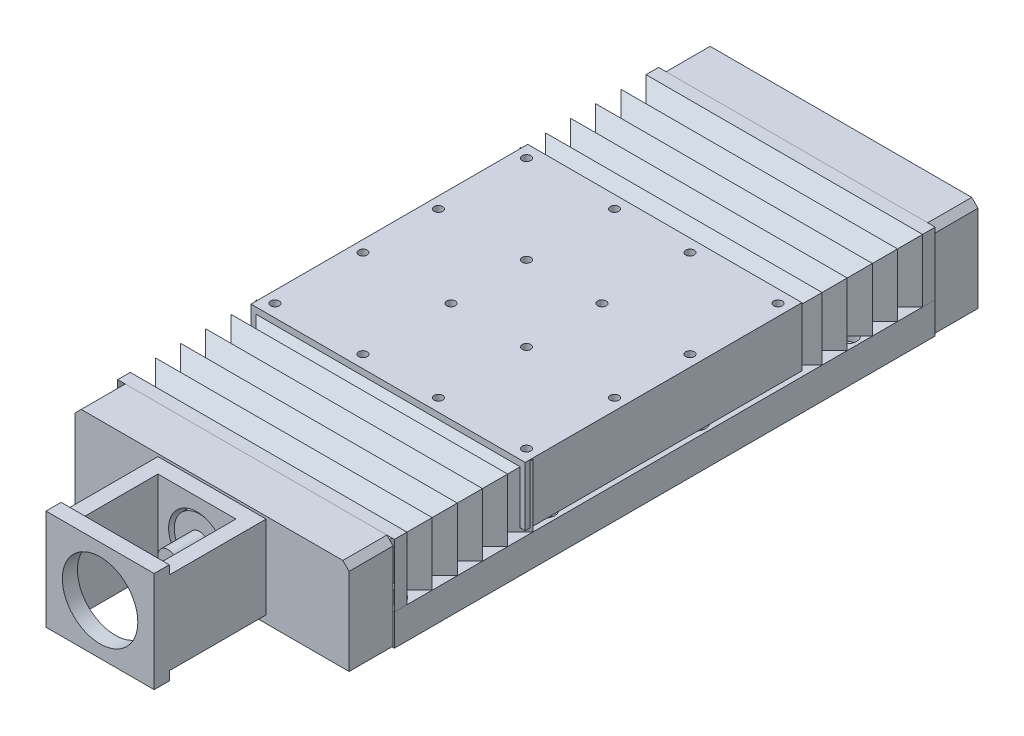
SolidWorks part; units mm, degrees
ref_plane "前视基准面" through (0, 0, 0) normal (0, 0, 1) x (1, 0, 0)
ref_plane "上视基准面" through (0, 0, 0) normal (0, 1, 0) x (1, 0, 0)
ref_plane "右视基准面" through (0, 0, 0) normal (1, 0, 0) x (0, 0, -1)
sketch "草图1" plane through (0, 0, 0) normal (0, 0, 1) x (1, 0, 0)
  line L0 (51.5, 0) -> (-51.5, 0)
  line L1 (-51.5, 0) -> (-51.5, 16)
  line L2 (-51.5, 16) -> (-70, 16)
  line L3 (-70, 16) -> (-70, 13)
  line L4 (-70, 13) -> (-90, 13)
  line L5 (-90, 13) -> (-90, 11)
  line L6 (-90, 11) -> (-110, 11)
  line L7 (-110, 11) -> (-110, -14)
  line L8 (-110, -14) -> (110, -14)
  line L9 (0, -14) -> (0, 0) construction
  line L10 (110, 11) -> (110, -14)
  line L11 (90, 11) -> (110, 11)
  line L12 (90, 13) -> (90, 11)
  line L13 (70, 13) -> (90, 13)
  line L14 (70, 16) -> (70, 13)
  line L15 (51.5, 16) -> (70, 16)
  line L16 (51.5, 0) -> (51.5, 16)
  dimension "D1" = 51.5
  dimension "D2" = 30
  dimension "D3" = 27
  dimension "D4" = 25
  dimension "D5" = 70
  dimension "D6" = 90
  dimension "D7" = 110
  dimension "D8" = 14
extrude "凸台-拉伸1" add sketch "草图1" along normal blind 430
sketch "草图2" plane through (0, 0, 430) normal (0, 0, 1) x (1, 0, 0)
  line L0 (-110, -14) -> (110, -14) construction
  line L1 (-70, -14) -> (70, -14)
  line L2 (-70, -14) -> (-70, -13)
  line L3 (-70, -13) -> (70, -13)
  line L4 (70, -14) -> (70, -13)
  line L5 (0, 0) -> (0, -14) construction
  dimension "D1" = 140
  dimension "D2" = 1
extrude "切除-拉伸1" cut sketch "草图2" against normal through all
ref_plane "基准面1" through (0, 0, 215) normal (0, 0, 1) x (1, 0, 0)
sketch "草图4" plane through (0, 13, 0) normal (0, 1, 0) x (1, 0, 0)
  line L0 (0, 0) -> (0, -430) construction
  line L1 (-90, 0) -> (-70, 0)
  line L2 (-90, 0) -> (-90, -430)
  line L3 (-90, -430) -> (-70, -430)
  line L4 (-70, 0) -> (-70, -430)
  line L5 (51.5, -430) -> (-51.5, -430) construction
  line L6 (70, 0) -> (70, -430)
  line L7 (90, -430) -> (70, -430)
  line L8 (90, 0) -> (90, -430)
  line L9 (90, 0) -> (70, 0)
extrude "凸台-拉伸2" add sketch "草图4" along normal blind 30 separate body
sketch "草图5" plane through (0, 0, 215) normal (0, 0, 1) x (1, 0, 0)
  line L0 (-70, 43) -> (70, 43) construction
  line L1 (0, 43) -> (0, 0) construction
  line L2 (-80, 43) -> (-80, 61) construction
  line L3 (-90, 43) -> (-70, 43) construction
  line L4 (-80, 61) -> (80, 61)
  line L5 (0, 61) -> (0, 43) construction
  line L6 (-80, 61) -> (-109, 61)
  line L7 (-109, 61) -> (-109, 14)
  line L8 (-109, 14) -> (-101, 14)
  line L9 (-101, 14) -> (-101, 43)
  line L10 (-101, 43) -> (-90, 43)
  line L11 (-59, 43) -> (-59, 41)
  line L12 (-59, 41) -> (-33, 41)
  line L13 (-33, 41) -> (-33, 43)
  line L14 (-33, 43) -> (33, 43)
  line L15 (-59, 43) -> (-70, 43)
  line L16 (-70, 43) -> (-90, 43)
  line L17 (80, 43) -> (80, 61) construction
  line L18 (70, 43) -> (90, 43)
  line L19 (59, 43) -> (70, 43)
  line L20 (33, 41) -> (33, 43)
  line L21 (59, 41) -> (33, 41)
  line L22 (59, 43) -> (59, 41)
  line L23 (101, 43) -> (90, 43)
  line L24 (101, 14) -> (101, 43)
  line L25 (109, 14) -> (101, 14)
  line L26 (109, 61) -> (109, 14)
  line L27 (80, 61) -> (109, 61)
  dimension "D1" = 109
  dimension "D2" = 42
  dimension "D3" = 21
  dimension "D4" = 20
  dimension "D5" = 47
  dimension "D6" = 18
  dimension "D7" = 33
extrude "凸台-拉伸3" add sketch "草图5" along normal mid plane 220
sketch "草图6" plane through (0, 0, 325) normal (0, 0, 1) x (1, 0, 0)
  line L0 (0, 61) -> (0, 43) construction
  line L1 (-33, 43) -> (33, 43)
  line L2 (-33, 43) -> (-33, 0)
  line L3 (-33, 0) -> (33, 0)
  line L4 (33, 43) -> (33, 0)
  line L5 (109, 61) -> (-109, 61) construction
  dimension "D1" = 61
extrude "凸台-拉伸4" add sketch "草图6" against normal blind 100
sketch "草图7" plane through (0, 0, 325) normal (0, 0, 1) x (1, 0, 0)
  line L0 (0, 61) -> (0, 26) construction
  line L1 (109, 61) -> (-109, 61) construction
  circle A0 centre (0, 26) radius 15
  dimension "D2" = 30
  dimension "D1" = 35
extrude "切除-拉伸2" cut sketch "草图7" against normal through all
sketch "草图8" plane through (0, 0, 325) normal (0, 0, 1) x (1, 0, 0)
  circle A0 centre (0, 26) radius 20
  dimension "D1" = 40
extrude "切除-拉伸3" cut sketch "草图8" against normal blind 65
sketch "草图9" plane through (0, 0, 430) normal (0, 0, 1) x (1, 0, 0)
  line L0 (70, -13) -> (-70, -13) construction
  line L1 (-109, 61) -> (109, 61)
  line L2 (-109, 61) -> (-109, -13)
  line L3 (-109, -13) -> (109, -13)
  line L4 (109, 61) -> (109, -13)
  line L5 (109, 14) -> (109, 61) construction
extrude "凸台-拉伸5" add sketch "草图9" along normal blind 35 separate body
mirror "镜向1" about plane through (0, 0, 215) normal (0, 0, 1)
sketch "草图10" plane through (0, 0, 0) normal (0, 0, 1) x (1, 0, 0)
  line L0 (0, 61) -> (0, 26) construction
  line L1 (109, 61) -> (-109, 61) construction
  circle A0 centre (0, 26) radius 12.5
  dimension "D2" = 25
  dimension "D1" = 35
extrude "凸台-拉伸6" add sketch "草图10" along normal up to surface (465 mm away) separate body
sketch "草图12" plane through (0, 0, 465) normal (0, 0, 1) x (1, 0, 0)
  circle A0 centre (0, 26) radius 8
  dimension "D1" = 16
extrude "凸台-拉伸7" add sketch "草图12" along normal blind 35
sketch "草图13" plane through (0, 0, 465) normal (0, 0, 1) x (1, 0, 0)
  circle A0 centre (0, 26) radius 20
  dimension "D1" = 40
extrude "凸台-拉伸8" add sketch "草图13" along normal blind 10
chamfer "倒角2" distance 5 angle 45 2 edges at (-109, 61, -17.5) (109, 61, -17.5)
chamfer "倒角3" distance 5 angle 45 2 edges at (-109, 61, 447.5) (109, 61, 447.5)
sketch "草图14" plane through (0, 11, 0) normal (0, 1, 0) x (1, 0, 0)
  line L0 (-110, 0) -> (-110, -10)
  line L1 (-110, -430) -> (-110, 0) construction
  line L2 (-110, -10) -> (-100, -20)
  line L3 (-100, -20) -> (-110, -30)
  line L4 (-100, -20) -> (-110, -20) construction
  line L9 (-100, -40) -> (-110, -50)
  line L10 (-110, -30) -> (-100, -40)
  line L11 (-100, -60) -> (-110, -70)
  line L12 (-110, -50) -> (-100, -60)
  line L13 (-100, -80) -> (-110, -90)
  line L14 (-110, -70) -> (-100, -80)
  line L15 (-100, -100) -> (-110, -110)
  line L16 (-110, -90) -> (-100, -100)
  line L23 (-100, -120) -> (-110, -130)
  line L24 (-110, -110) -> (-100, -120)
  dimension "D1" = 90
  dimension "D2" = 45
  dimension "D3" = 10
  dimension "D4" = 20
  dimension "D5" = 5
sketch "草图15" plane through (0, 0, 0) normal (0, 0, 1) x (1, 0, 0)
  line L0 (110, -14) -> (110, 11) construction
  line L1 (-110, 11) -> (110, 11) construction
  line L2 (-110, 11) -> (-110, 61)
  line L3 (-110, 61) -> (110, 61)
  line L4 (110, 11) -> (110, 61)
  line L5 (104, 61) -> (-104, 61) construction
surface "曲面-扫描1"
mirror "镜向2" about plane through (0, 0, 215) normal (0, 0, 1)
sketch "草图16" plane through (0, 0, 465) normal (0, 0, 1) x (1, 0, 0)
  line L0 (0, 26) -> (0, 59) construction
  line L1 (-43, 59) -> (43, 59)
  line L2 (-43, 59) -> (-43, -7)
  line L3 (-43, -7) -> (43, -7)
  line L4 (43, 59) -> (43, -7)
  line L5 (0, 26) -> (43, 26) construction
  line L6 (43, 26) -> (26.7624, 26) construction
  circle A0 centre (0, 26) radius 22.5
  dimension "D3" = 45
  dimension "D1" = 86
  dimension "D2" = 66
extrude "凸台-拉伸9" add sketch "草图16" along normal blind 12
sketch "草图17" plane through (0, 0, 477) normal (0, 0, 1) x (1, 0, 0)
  line L0 (-43, -7) -> (43, -7) construction
  line L1 (-43, 59) -> (-31, 59)
  line L2 (-43, 59) -> (-43, -7)
  line L3 (-43, -7) -> (-31, -7)
  line L4 (-31, 59) -> (-31, -7)
  line L5 (0, 26) -> (0, -7) construction
  line L6 (-43, -7) -> (43, -7) construction
  line L7 (31, 59) -> (31, -7)
  line L8 (43, -7) -> (31, -7)
  line L9 (43, 59) -> (43, -7)
  line L10 (43, 59) -> (31, 59)
  dimension "D1" = 12
extrude "凸台-拉伸10" add sketch "草图17" along normal blind 65
sketch "草图18" plane through (0, 0, 542) normal (0, 0, 1) x (1, 0, 0)
  line L0 (43, -7) -> (43, 59) construction
  line L1 (-43, 66) -> (43, 66)
  line L2 (-43, 66) -> (-43, -14)
  line L3 (-43, -14) -> (43, -14)
  line L4 (43, 66) -> (43, -14)
  line L5 (-43, 59) -> (-43, -7) construction
  line L6 (0, 26) -> (43, 26) construction
  circle A0 centre (0, 26) radius 30
  dimension "D2" = 60
  dimension "D1" = 80
extrude "凸台-拉伸11" add sketch "草图18" along normal blind 12
sketch "草图19" plane through (0, 0, 554) normal (0, 0, 1) x (1, 0, 0)
  line L1 (-43, 61) -> (43, 61)
  line L2 (-43, 61) -> (-43, -14)
  line L3 (-43, -14) -> (43, -14)
  line L4 (43, 61) -> (43, -14)
  line L6 (-43, 66) -> (-43, -14) construction
  dimension "D1" = 75
extrude "凸台-拉伸12" [suppressed] add sketch "草图19" along normal blind 118 separate body
sketch "草图20" [suppressed] plane through (0, 0, 602) normal (0, 0, 1) x (1, 0, 0)
  circle A0 centre (-43, 61) radius 18
  dimension "D1" = 36
extrude "切除-拉伸4" [suppressed] cut sketch "草图20" against normal blind 108
pattern_circular "阵列(圆周)1" [suppressed] count 4 over 360
sketch "草图21" [suppressed] plane through (0, 0, 484) normal (0, 0, -1) x (-1, 0, 0)
  circle A0 centre (0, 26) radius 6.35
  dimension "D1" = 12.7
extrude "凸台-拉伸13" [suppressed] add sketch "草图21" along normal blind 30 separate body
sketch "草图22" plane through (0, 61, 0) normal (0, 1, 0) x (1, 0, 0)
  line L0 (0, -215) -> (0, -325) construction
  line L1 (-100, -115) -> (-30, -115) construction
  line L2 (-100, -115) -> (-100, -185) construction
  line L3 (-100, -185) -> (-30, -185) construction
  line L4 (-30, -115) -> (-30, -185) construction
  line L6 (109, -325) -> (-109, -325) construction
  line L7 (110, -215) -> (-110, -215) construction
  line L8 (110, -430) -> (110, 0) construction
  line L9 (-110, -430) -> (-110, 0) construction
  line L10 (30, -115) -> (30, -185) construction
  line L11 (100, -185) -> (30, -185) construction
  line L12 (100, -115) -> (100, -185) construction
  line L13 (100, -115) -> (30, -115) construction
  line L14 (100, -315) -> (30, -315) construction
  line L15 (100, -315) -> (100, -245) construction
  line L16 (100, -245) -> (30, -245) construction
  line L17 (30, -315) -> (30, -245) construction
  line L18 (-30, -315) -> (-30, -245) construction
  line L19 (-100, -245) -> (-30, -245) construction
  line L20 (-100, -315) -> (-100, -245) construction
  line L21 (-100, -315) -> (-30, -315) construction
  dimension "D1" = 70
  dimension "D2" = 70
  dimension "D3" = 30
  dimension "D4" = 30
hole_wizard "M8 螺纹孔1" positions "3D草图1" profile "草图24" tap size "M8" standard "GB"
sketch3d "3D草图1"
  point P0 (-100, 61, 115)
  point P3 (-30, 61, 115)
  point P6 (-100, 61, 185)
  point P9 (-30, 61, 185)
  point P12 (30, 61, 185)
  point P15 (30, 61, 115)
  point P20 (100, 61, 185)
  point P23 (100, 61, 115)
  point P26 (100, 61, 245)
  point P29 (100, 61, 315)
  point P32 (30, 61, 315)
  point P35 (30, 61, 245)
  point P38 (-30, 61, 245)
  point P41 (-30, 61, 315)
  point P44 (-100, 61, 315)
  point P47 (-100, 61, 245)
sketch "草图24" plane through (-100, 61, 115) normal (1, 0, 0) x (0, 0, 1)
  line L0 (0, 0) -> (0, 24.2929)
  line L1 (0, 24.2929) -> (3.4, 22.25)
  line L2 (3.4, 22.25) -> (3.4, 0)
  line L5 (3.4, 0) -> (0, 0)
  line L10 (0, 24.2929) -> (-3.4, 22.25) construction
  line L11 (0, -6.35) -> (0, 107.95) construction
  dimension "螺纹孔钻头直径" = 6.8
  dimension "螺纹孔钻头深度" = 22.25
  dimension "导头角度" = 118
sketch "草图25" plane through (0, 11, 0) normal (0, 1, 0) x (1, 0, 0)
  line L0 (-100, 0) -> (-100, -430) construction
  line L1 (110, 0) -> (-110, 0) construction
  line L3 (104, -430) -> (-104, -430) construction
  line L4 (0, 0) -> (0, -500) construction
  line L5 (104, 0) -> (-104, 0) construction
  line L6 (-8, -500) -> (8, -500) construction
  point P11 (-100, -60)
  dimension "D1" = 100
  dimension "D2" = 60
hole_wizard "打孔尺寸根据内六角圆柱头螺钉的类型1" positions "3D草图2" profile "草图26" counterbore size "M8" standard "GB"
sketch3d "3D草图2"
  point P0 (-100, 11, 60)
sketch "草图26" plane through (-100, 11, 60) normal (1, 0, 0) x (0, 0, 1)
  line L0 (0, 0) -> (0, 25)
  line L1 (0, 25) -> (4.5, 25)
  line L3 (4.5, 25) -> (4.5, 9)
  line L4 (4.5, 9) -> (7.5, 9)
  line L5 (7.5, 9) -> (7.5, 0)
  line L7 (7.5, 0) -> (0, 0)
  line L11 (0, -6.35) -> (0, 107.95) construction
  dimension "通孔孔直径" = 9
  dimension "通孔孔深度" = 25
  dimension "柱形沉头孔直径" = 15
  dimension "柱形沉头孔深度" = 9
pattern_linear "阵列(线性)1" count 4 spacing 120 along (0, 0, 1) of "打孔尺寸根据内六角圆柱头螺钉的类型1"
ref_plane "基准面2" through (0, 0, 0) normal (-1, 0, 0) x (0, 0, 1)
mirror "镜向3" about plane through (0, 0, 0) normal (-1, 0, 0) of "阵列(线性)1", "打孔尺寸根据内六角圆柱头螺钉的类型1"
sketch "草图27" plane through (0, 0, 554) normal (0, 0, 1) x (1, 0, 0)
  line L1 (-43, 66) -> (43, 66)
  line L2 (-43, 66) -> (-43, -14)
  line L3 (-43, -14) -> (43, -14)
  line L4 (43, 66) -> (43, -14)
extrude "凸台-拉伸14" [suppressed] add sketch "草图27" along normal blind 127 separate body
sketch "草图28" [suppressed] plane through (0, 0, 611) normal (0, 0, 1) x (1, 0, 0)
  circle A0 centre (-43, 66) radius 20
  dimension "D1" = 40
extrude "切除-拉伸5" [suppressed] cut sketch "草图28" against normal blind 117
pattern_circular "阵列(圆周)2" [suppressed] count 4 every 90
fillet "圆角1" [suppressed] radius 3
sketch "草图29" [suppressed] plane through (0, 0, 484) normal (0, 0, -1) x (-1, 0, 0)
  circle A0 centre (0, 26) radius 9.5
  dimension "D1" = 19
extrude "凸台-拉伸15" [suppressed] add sketch "草图29" along normal blind 40 separate body
